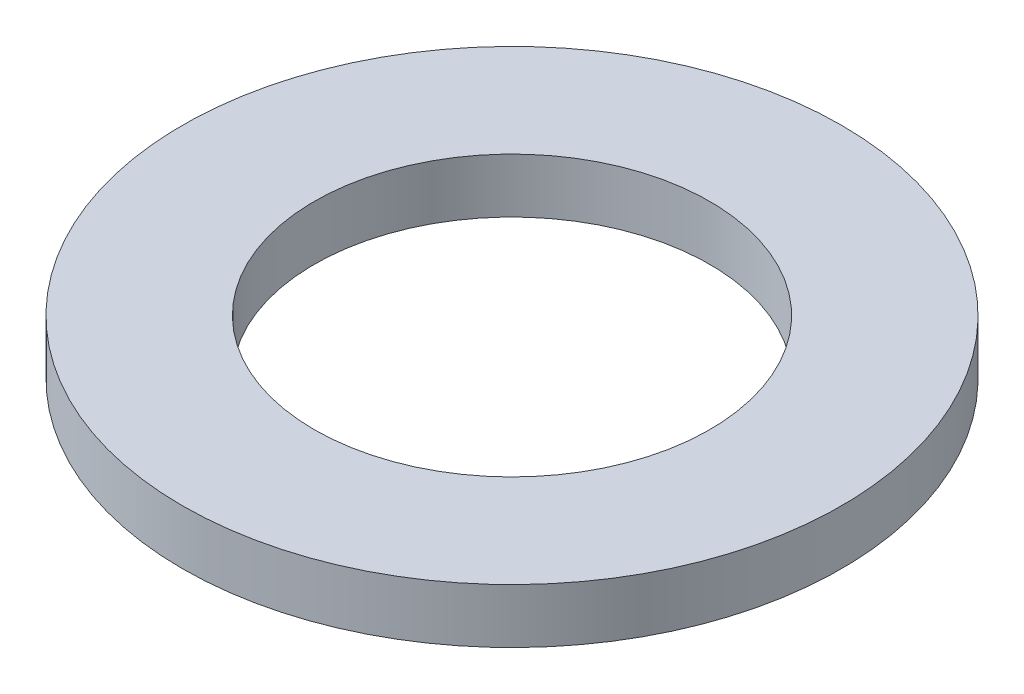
SolidWorks part; units mm, degrees
ref_plane "Front" through (0, 0, 0) normal (0, 0, 1) x (1, 0, 0)
ref_plane "Top" through (0, 0, 0) normal (0, 1, 0) x (1, 0, 0)
ref_plane "Right" through (0, 0, 0) normal (1, 0, 0) x (0, 0, -1)
sketch "Sketch1" plane through (0, 0, 0) normal (0, 1, 0) x (1, 0, 0)
  circle A0 centre (0, 0) radius 43.5
  circle A1 centre (0, 0) radius 72.5
extrude "Extrude1" add sketch "Sketch1" along normal blind 12
